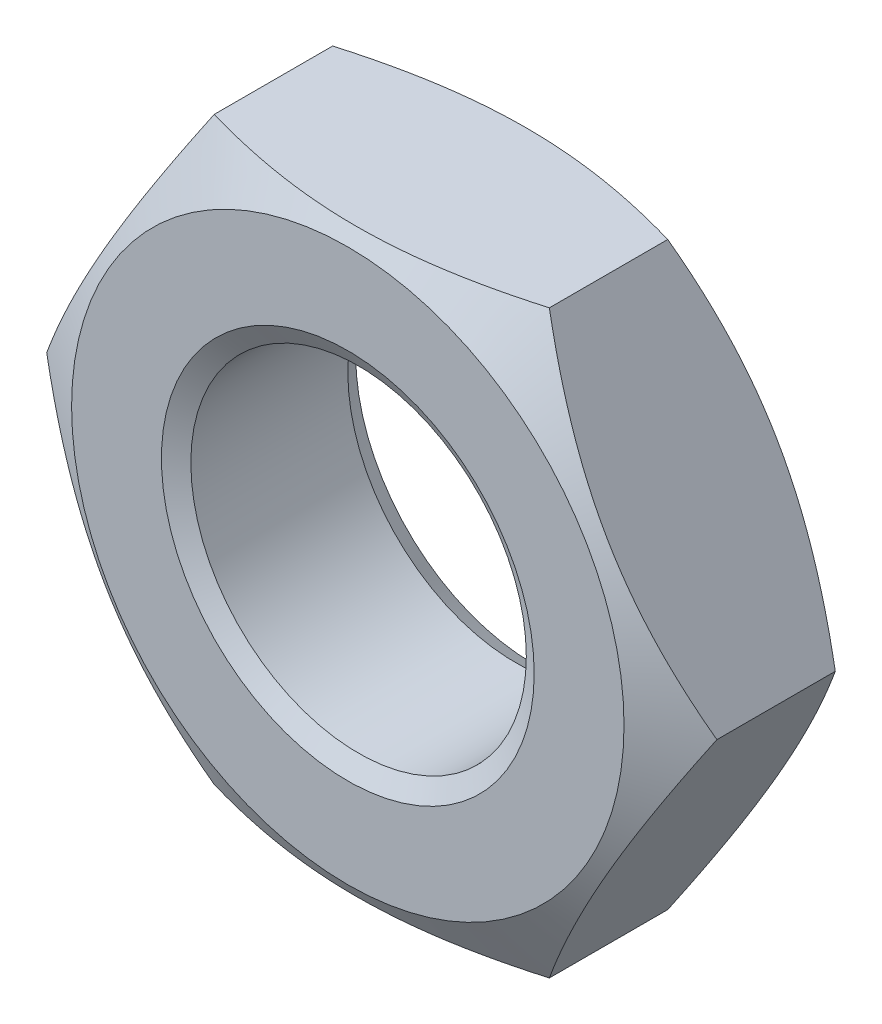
SolidWorks part; units mm, degrees
ref_plane "Front" through (0, 0, 0) normal (0, 0, 1) x (1, 0, 0)
ref_plane "Top" through (0, 0, 0) normal (0, 1, 0) x (1, 0, 0)
ref_plane "Right" through (0, 0, 0) normal (1, 0, 0) x (0, 0, -1)
sketch "Sketch1" plane through (0, 0, 0) normal (0, 0, 1) x (1, 0, 0)
  line L1 (4.4947, -7.785) -> (8.9893, 0)
  line L2 (8.9893, 0) -> (4.4947, 7.785)
  line L3 (4.4947, 7.785) -> (-4.4947, 7.785)
  line L4 (-4.4947, 7.785) -> (-8.9893, 0)
  line L5 (-8.9893, 0) -> (-4.4947, -7.785)
  line L6 (-4.4947, -7.785) -> (4.4947, -7.785)
  circle A0 centre (0, 0) radius 7.785 construction
  circle A1 centre (0, 0) radius 4.5
  dimension "D" = 9
  dimension "s" = 15.57
extrude "BaseNut" add sketch "Sketch1" against normal blind 5
sketch "Sketch2" plane through (0, 0, 0) normal (0, 1, 0) x (1, 0, 0)
  line L0 (-8.9893, 5) -> (-7.41, 5)
  line L2 (-7.41, 5) -> (-8.9893, 4.0882)
  line L3 (-8.9893, 4.0882) -> (-8.9893, 5)
  line L4 (0, 3.3759) -> (0, -9.8171) construction
  line L6 (-9.7712, 2.5) -> (9.8853, 2.5) construction
  line L7 (-8.9893, 0.9118) -> (-8.9893, 0)
  line L8 (-7.41, 0) -> (-8.9893, 0.9118)
  line L9 (-8.9893, 0) -> (-7.41, 0)
  dimension "D1" = 30
  dimension "dw" = 14.82
  dimension "D2" = 2.5
revolve "Double-Chamfer" cut sketch "Sketch2" angle 360 about L4
chamfer "EndChamfer" distance 0.5 angle 30 2 edges at (4.5, 0, -5) (4.5, 0, 0)
sketch "Sketch3" plane through (0, 0, 0) normal (0, 1, 0) x (1, 0, 0)
  line L0 (0, 6.7075) -> (0, -2.1252) construction
  line L1 (4, 4.75) -> (4.5, 4.75)
  line L2 (4.5, 4.75) -> (4.933, 4.5)
  line L3 (4.933, 4.5) -> (4.5, 4.25)
  line L4 (4.5, 4.25) -> (4, 4.25)
  line L5 (4, 4.25) -> (4, 4.75)
  line L6 (4.5, 4.5) -> (-4.5, 4.5) construction
  dimension "D1" = 0.5
  dimension "D2" = 9
revolve "Cut-Revolve10" [suppressed] cut sketch "Sketch3" angle 360 about L0
pattern_linear "LPattern10" [suppressed] count 8 spacing 0.6 along (0, 0, 1)
equation "\"dw@Sketch2\" = \"s@Sketch1\"-0.75"
equation "\"D2@Sketch2\" = \"m@BaseNut\" / 2"
equation "\"D1@EndChamfer\" = \"m@BaseNut\" / 10"
equation "\"D2@Sketch3\" = \"D@Sketch1\""
equation "\"D1@Sketch3\" = (  \"D@ThreadCosmetic1\" - \"D@Sketch1\" )  / 2"
equation "\"D3@LPattern10\" = \"D1@Sketch3\" * 1.2"
equation "\"D1@LPattern10\" = (  \"m@BaseNut\" - \"D1@EndChamfer\" )  / \"D3@LPattern10\" "
